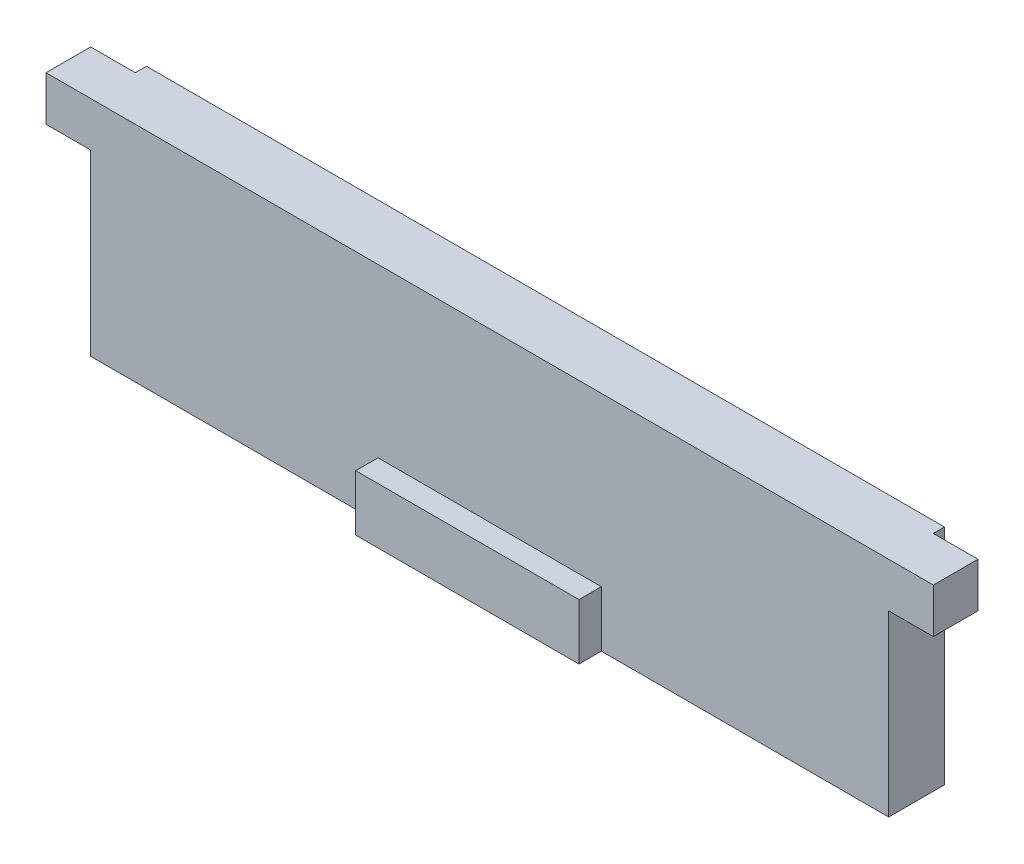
SolidWorks part; units mm, degrees
ref_plane "前视基准面" through (0, 0, 0) normal (0, 0, 1) x (1, 0, 0)
ref_plane "上视基准面" through (0, 0, 0) normal (0, 1, 0) x (1, 0, 0)
ref_plane "右视基准面" through (0, 0, 0) normal (1, 0, 0) x (0, 0, -1)
other "Configuration Table"
sketch "草图1" plane through (0, 0, 0) normal (0, 1, 0) x (1, 0, 0)
  line L5 (0, 0) -> (71.4852, 0)
  line L6 (0, 0) -> (0, 5)
  line L7 (0, 5) -> (71.4852, 5)
  line L8 (71.4852, 0) -> (71.4852, 5)
extrude "凸台-拉伸1" add sketch "草图1" along normal blind 20
sketch "草图3" plane through (0, 0, 0) normal (0, 0, 1) x (1, 0, 0)
  line L0 (0, 0) -> (71.4852, 0) construction
  line L1 (35.7426, 0) -> (45.7426, 0)
  line L2 (35.7426, 0) -> (35.7426, 5)
  line L3 (35.7426, 5) -> (45.7426, 5)
  line L4 (45.7426, 0) -> (45.7426, 5)
  line L6 (35.7426, 0) -> (25.7426, 0)
  line L7 (35.7426, 0) -> (35.7426, 5)
  line L8 (35.7426, 5) -> (25.7426, 5)
  line L9 (25.7426, 0) -> (25.7426, 5)
extrude "凸台-拉伸3" add sketch "草图3" along normal blind 2 contours L4 L3 L2 M9 | L9 L2 L8 M9
sketch "草图4" plane through (0, 20, 0) normal (0, 1, 0) x (1, 0, 0)
  line L1 (0, 0) -> (-4, 0)
  line L2 (0, 0) -> (0, 4)
  line L3 (0, 4) -> (-4, 4)
  line L4 (-4, 0) -> (-4, 4)
  line L5 (71.4852, 0) -> (75.4852, 0)
  line L6 (71.4852, 0) -> (71.4852, 4)
  line L7 (71.4852, 4) -> (75.4852, 4)
  line L8 (75.4852, 0) -> (75.4852, 4)
extrude "凸台-拉伸4" add sketch "草图4" against normal blind 4
